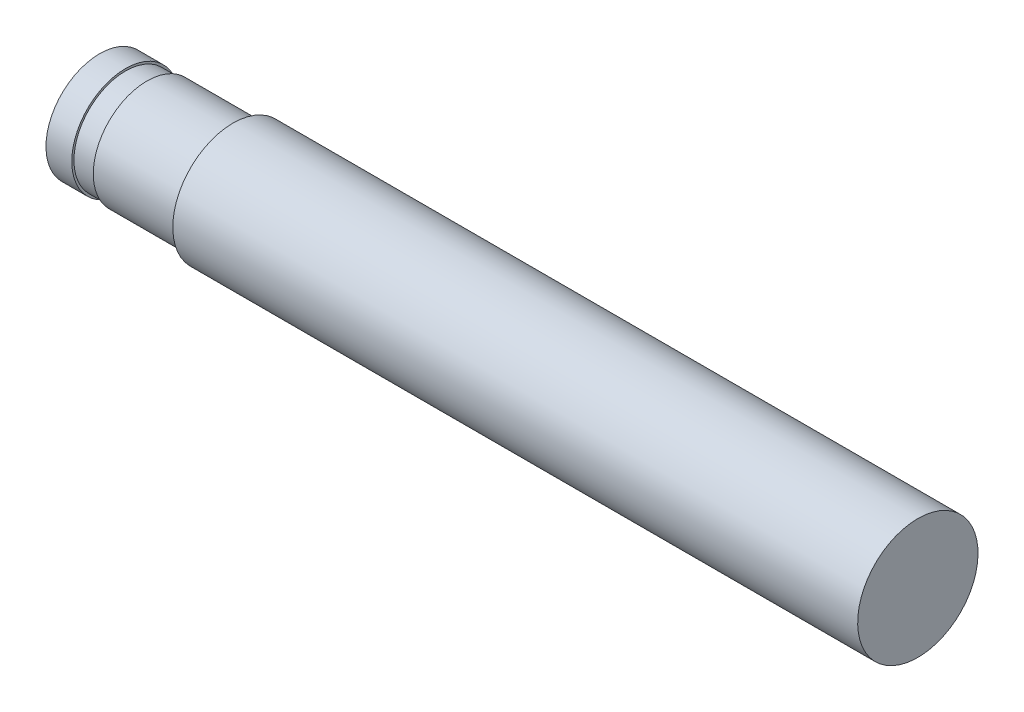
SolidWorks part; units mm, degrees
ref_plane "Front Plane" through (0, 0, 0) normal (0, 0, 1) x (1, 0, 0)
ref_plane "Top Plane" through (0, 0, 0) normal (0, 1, 0) x (1, 0, 0)
ref_plane "Right Plane" through (0, 0, 0) normal (1, 0, 0) x (0, 0, -1)
sketch "Sketch1" plane through (0, 0, 0) normal (0, 0, 1) x (1, 0, 0)
  line L0 (-571, 37.5) -> (-553, 37.5)
  line L1 (-478, 37.5) -> (-478, 42)
  line L2 (-478, 42) -> (0, 42)
  line L3 (0, 42) -> (0, 0)
  line L4 (0, 0) -> (-571, 0)
  line L6 (-571, 37.5) -> (-571, 0)
  line L8 (-553, 37.5) -> (-553, 36)
  line L9 (-553, 36) -> (-538, 36)
  line L10 (-538, 36) -> (-538, 37.5)
  line L11 (-538, 37.5) -> (-478, 37.5)
  dimension "D1" = 93
  dimension "D2" = 571
  dimension "D3" = 42
  dimension "D4" = 37.5
  dimension "D7" = 18
  dimension "D8" = 15
  dimension "D9" = 36
revolve "Revolve1" add sketch "Sketch1" angle 360 about L4
